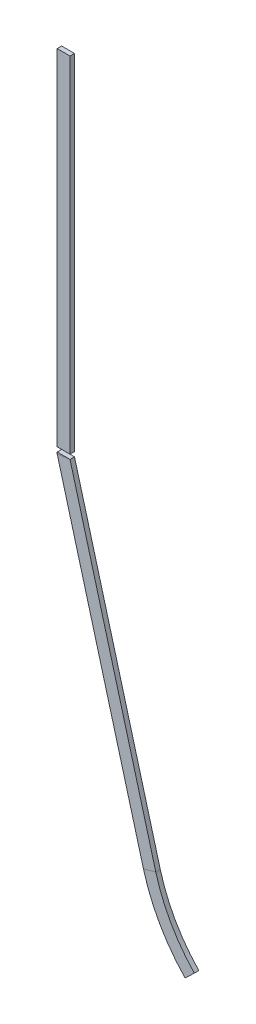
SolidWorks part; units mm, degrees
ref_plane "Front Plane" through (0, 0, 0) normal (0, 0, 1) x (1, 0, 0)
ref_plane "Top Plane" through (0, 0, 0) normal (0, 1, 0) x (1, 0, 0)
ref_plane "Right Plane" through (0, 0, 0) normal (1, 0, 0) x (0, 0, -1)
sketch "Sketch2" plane through (0, 0, 0) normal (0, 0, 1) x (1, 0, 0)
  line L1 (-319.8736, 461.9467) -> (162.5, 593.5358) construction
  line L2 (162.5, 593.5358) -> (-199.7611, 248.9101) construction
  line L3 (-607.5, 2533) -> (-607.5, 1440.321)
  line L4 (-607.5, 1440.321) -> (-339.1686, 456.6832)
  line L7 (-587.5, 2533) -> (-587.5, 1443) construction
  line L8 (-587.5, 1443) -> (-319.8736, 461.9467) construction
  line L10 (-14.3367, 29.5909) -> (-214.1744, 235.0439) construction
  line L11 (0, 43.5358) -> (-199.7611, 248.9101) construction
  arc A0 (-339.1686, 456.6832) -> (-214.1744, 235.0439) centre (162.5, 593.5358) ccw
  arc A1 (-319.8736, 461.9467) -> (-199.7611, 248.9101) centre (162.5, 593.5358) ccw construction
  dimension "D2" = 1016.9019
  dimension "D4" = 28.312
  dimension "D1" = 1440.321
  dimension "D5" = 593.5358
  dimension "D6" = 164.741
  dimension "D3" = 1090
  dimension "D8" = 587.5
  dimension "D9" = 20
ref_plane "Plane1" through (-607.5, 2533, 0) normal (0, -1, 0) x (-1, 0, 0)
sketch "Sketch3" plane through (-607.5, 2533, 0) normal (0, -1, 0) x (-1, 0, 0)
  line L1 (-20, 7) -> (20, 7)
  line L2 (-20, 7) -> (-20, -7)
  line L3 (-20, -7) -> (20, -7)
  line L4 (20, 7) -> (20, -7)
  line L5 (-20, 7) -> (20, -7) construction
  line L6 (-20, -7) -> (20, 7) construction
  point P0 (0, 0)
  dimension "D1" = 40
  dimension "D2" = 14
sweep "Sweep1" add profiles "Sketch3" path "Sketch2"
sketch "Sketch5" plane through (0, 0, 7) normal (0, 0, 1) x (1, 0, 0)
  line L0 (-587.5, 1443) -> (-627.5, 1443)
  line L1 (-627.5, 1443) -> (-627.5, 1457)
  line L2 (-627.5, 1457) -> (-587.5, 1457)
  line L3 (-587.5, 2533) -> (-587.5, 1443) construction
  line L4 (-587.5, 1457) -> (-587.5, 1443)
  line L5 (-627.5, 2533) -> (-627.5, 1437.642) construction
  line L6 (952.5, 1457) -> (-627.5, 1457) construction
extrude "Cut-Extrude2" cut sketch "Sketch5" against normal up to surface (14 mm away) contours L0 L1 L2 L4
